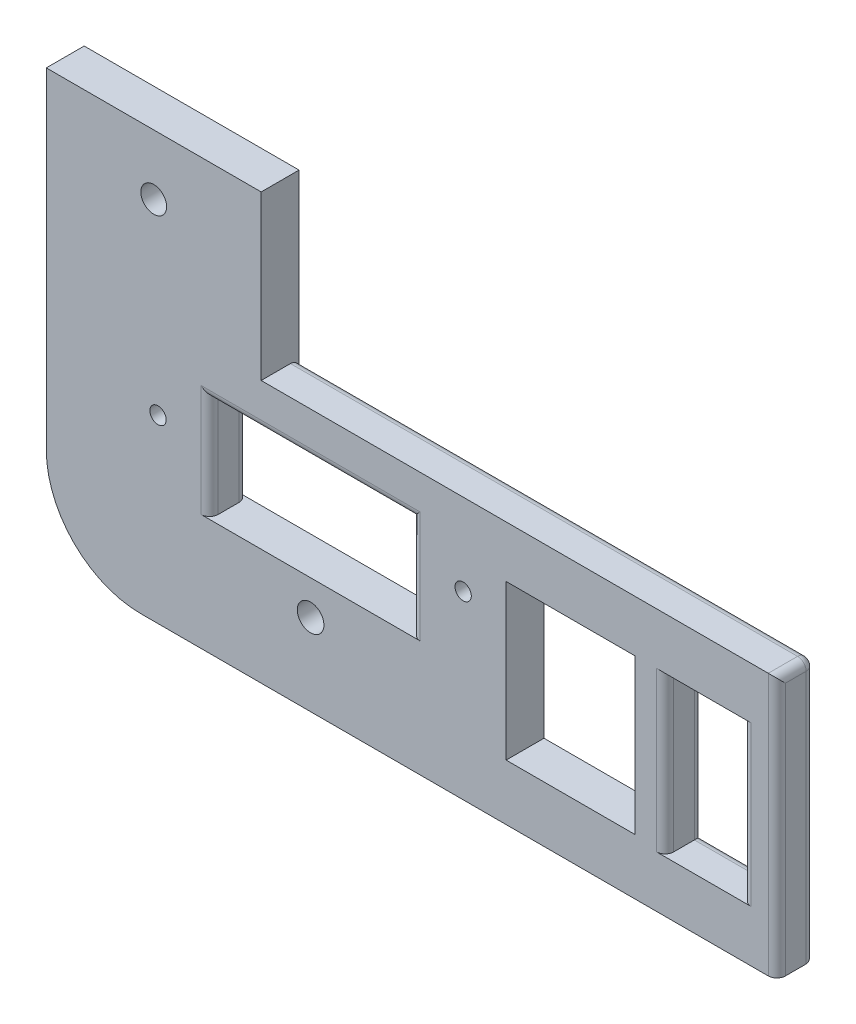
SolidWorks part; units mm, degrees
ref_plane "前视基准面" through (0, 0, 0) normal (0, 0, 1) x (1, 0, 0)
ref_plane "上视基准面" through (0, 0, 0) normal (0, 1, 0) x (1, 0, 0)
ref_plane "右视基准面" through (0, 0, 0) normal (1, 0, 0) x (0, 0, -1)
sketch "草图1" plane through (0, 0, 0) normal (0, 1, 0) x (1, 0, 0)
  line L1 (-37.5, -2.5) -> (37.5, -2.5)
  line L2 (-37.5, -2.5) -> (-37.5, 2.5)
  line L3 (-37.5, 2.5) -> (37.5, 2.5)
  line L4 (37.5, -2.5) -> (37.5, 2.5)
  line L5 (-37.5, -2.5) -> (37.5, 2.5) construction
  line L6 (-37.5, 2.5) -> (37.5, -2.5) construction
  point P0 (0, 0)
  dimension "D1" = 75
  dimension "D2" = 5
extrude "凸台-拉伸1" add sketch "草图1" along normal blind 30.5
sketch "草图2" plane through (0, 0, 0) normal (0, -1, 0) x (1, 0, 0)
  line L0 (37.5, 2.5) -> (37.5, -2.5) construction
  line L1 (-37.5, 2.5) -> (37.5, 2.5)
  line L2 (-37.5, 2.5) -> (-37.5, 6.8803)
  line L3 (-37.5, 6.8803) -> (37.5, 6.8803)
  line L4 (37.5, 2.5) -> (37.5, 6.8803)
sketch "草图9" plane through (0, 0, -2.5) normal (0, 0, -1) x (-1, 0, 0)
  line L1 (-37.5, 30.5) -> (37.5, 30.5)
  line L2 (-37.5, 30.5) -> (-37.5, 0)
  line L3 (-37.5, 0) -> (37.5, 0)
  line L4 (37.5, 30.5) -> (37.5, 0)
extrude "凸台-拉伸2" add sketch "草图9" along normal blind 18
sketch "草图10" plane through (37.5, 0, 0) normal (1, 0, 0) x (0, 0, -1)
  line L0 (-2.5, 30.5) -> (20.5, 30.5) construction
  line L1 (19, 30.5) -> (2, 30.5)
  line L2 (19, 30.5) -> (19, 0)
  line L3 (19, 0) -> (2, 0)
  line L4 (2, 30.5) -> (2, 0)
  line L5 (-2.5, 0) -> (20.5, 0) construction
  line L6 (20.5, 30.5) -> (20.5, 0) construction
  dimension "D1" = 17
  dimension "D2" = 1.5
extrude "切除-拉伸6" cut sketch "草图10" against normal blind 50
sketch "草图12" plane through (0, 0, -20.5) normal (0, 0, -1) x (-1, 0, 0)
  line L1 (-37.5, 30.5) -> (-37.5, 0) construction
  line L4 (37.5, 0) -> (37.5, 30.5) construction
  line L6 (37.5, 0) -> (-37.5, 0)
  line L7 (-37.5, 0) -> (-37.5, 7.8755)
  line L17 (37.5, 7.8755) -> (37.5, 0)
  line L33 (6, 7.8755) -> (37.5, 7.8755)
  line L35 (-37.5, 7.8755) -> (-6, 7.8755)
  line L36 (-6, 7.8755) -> (-6, 17.1015)
  line L37 (6, 7.8755) -> (6, 17.1015)
  line L38 (6, 17.1015) -> (-6, 17.1015)
extrude "切除-拉伸7" cut sketch "草图12" against normal blind 3
fillet "圆角4" radius 1 15 edges at (-37.5, 30.5, -9) (37.5, 19.1878, -20.5) (0, 30.5, -20.5) (37.5, 15.25, -2) (-37.5, 19.1878, -20.5) (-37.5, 0, -7.5) (-37.5, 3.9378, -17.5) (-37.5, 7.8755, -19) (21.75, 7.8755, -20.5) (-21.75, 7.8755, -20.5) (-6, 12.4885, -20.5) (0, 17.1015, -20.5) (6, 12.4885, -20.5) (37.5, 0, 0.25) (-37.5, 15.25, 2.5)
sketch "草图13" plane through (0, 0, -2) normal (0, 0, -1) x (-1, 0, 0)
  line L0 (-37.5, 7.8755) -> (-37.5, 29.5) construction
  line L1 (-37.5, 27.5) -> (-23.0283, 27.5)
  line L2 (-37.5, 27.5) -> (-37.5, 7.8391)
  line L3 (-37.5, 7.8391) -> (-23.0283, 7.8391)
  line L4 (-23.0283, 27.5) -> (-23.0283, 7.8391)
  dimension "D1" = 0
extrude "凸台-拉伸3" add sketch "草图13" along normal blind 18
sketch "草图14" plane through (0, 0, 2.5) normal (0, 0, 1) x (1, 0, 0)
  line L0 (-37.5, 0) -> (37.5, 0) construction
  line L1 (-36.5, 30.5) -> (37.5, 30.5) construction
  line L3 (37.5, 30.5) -> (37.5, 1) construction
  circle A0 centre (-11, 21) radius 0.95
  circle A1 centre (24.5, 21) radius 0.95
  dimension "D1" = 9.5
  dimension "D5" = 1.9
  dimension "D6" = 1.9
  dimension "D2" = 9.5
  dimension "D3" = 35.5
  dimension "D4" = 13
  dimension "D7" = 21
extrude "切除-拉伸8" cut sketch "草图14" against normal blind 10
sketch "草图15" plane through (0, 0, 0) normal (0, -1, 0) x (1, 0, 0)
  line L1 (-49.3528, -27.582) -> (48.6246, -27.582)
  line L2 (-49.3528, -27.582) -> (-49.3528, -1.9067)
  line L3 (-49.3528, -1.9067) -> (48.6246, -1.9067)
  line L4 (48.6246, -27.582) -> (48.6246, -1.9067)
extrude "切除-拉伸9" cut sketch "草图15" against normal blind 50
sketch "草图17" plane through (0, 0, -1.9067) normal (0, 0, -1) x (-1, 0, 0)
  line L0 (-36.5, 0) -> (36.5, 0) construction
  line L1 (-23.3164, 23.05) -> (-25.6836, 23.05)
  line L2 (-25.6836, 23.05) -> (-26.8671, 21)
  line L3 (-26.8671, 21) -> (-25.6836, 18.95)
  line L4 (-25.6836, 18.95) -> (-23.3164, 18.95)
  line L5 (-23.3164, 18.95) -> (-22.1329, 21)
  line L6 (-22.1329, 21) -> (-23.3164, 23.05)
  line L7 (12.1836, 23.05) -> (9.8164, 23.05)
  line L8 (9.8164, 23.05) -> (8.6329, 21)
  line L9 (8.6329, 21) -> (9.8164, 18.95)
  line L10 (9.8164, 18.95) -> (12.1836, 18.95)
  line L11 (12.1836, 18.95) -> (13.3671, 21)
  line L12 (13.3671, 21) -> (12.1836, 23.05)
  circle A0 centre (-24.5, 21) radius 2.05 construction
  circle A1 centre (11, 21) radius 2.05 construction
  dimension "D1" = 4.1
  dimension "D2" = 4.1
extrude "切除-拉伸11" cut sketch "草图17" against normal blind 2
sketch "草图18" plane through (0, 0, -1.9067) normal (0, 0, -1) x (-1, 0, 0)
  line L0 (11, 21) -> (-24.5, 21)
  line L1 (-6.75, 21) -> (-6.75, 0)
  line L2 (-36.5, 0) -> (36.5, 0) construction
  line L3 (-6.75, 0) -> (-6.75, 9.5)
  line L4 (-6.75, 9.5) -> (-6.75, 2.75)
  circle A0 centre (-6.75, 9.5) radius 1.55
  point P13 (-6.75, 2.75)
  dimension "D2" = 3.1
  dimension "D1" = 9.5
extrude "切除-拉伸15" cut sketch "草图18" against normal through all and the other way through all contours L1 A0 | L1 A0
sketch "草图19" plane through (0, 30.5, 0) normal (0, 1, 0) x (1, 0, 0)
  line L1 (-37.5, 1.9067) -> (37.5, 1.9067)
  line L2 (-37.5, 1.9067) -> (-37.5, -2.5)
  line L3 (-37.5, -2.5) -> (37.5, -2.5)
  line L4 (37.5, 1.9067) -> (37.5, -2.5)
fillet "圆角12" radius 1 1 edges at (37.5, 30.5, 0.75)
sketch "草图21" plane through (0, 0, -1.9067) normal (0, 0, -1) x (-1, 0, 0)
  line L0 (11, 21) -> (-24.5, 21)
  line L1 (37.5, 30.5) -> (-37.5, 30.5) construction
  line L2 (-18.5, 25.5) -> (5, 25.5)
  line L3 (-18.5, 25.5) -> (-18.5, 16.5)
  line L4 (-18.5, 16.5) -> (5, 16.5)
  line L5 (5, 25.5) -> (5, 16.5)
  line L6 (-18.5, 25.5) -> (5, 16.5) construction
  line L7 (-18.5, 16.5) -> (5, 25.5) construction
  line L9 (-18.5, 16.5) -> (5, 16.5)
  line L10 (-18.5, 16.5) -> (-18.5, 13.5)
  line L11 (-18.5, 13.5) -> (5, 13.5)
  line L12 (5, 16.5) -> (5, 13.5)
  point P4 (-6.75, 21)
  dimension "D1" = 6
  dimension "D2" = 5
  dimension "D3" = 3
extrude "切除-拉伸19" cut sketch "草图21" against normal through all contours L5 L0 L3 L4 | L5 L2 L3 L0 | L12 L4 L10 L11
fillet "圆角13" radius 1 6 edges at (-5, 19.5, 2.5) (6.75, 25.5, 2.5) (18.5, 19.5, 2.5) (6.75, 25.5, -1.9067) (18.5, 19.5, -1.9067) (-5, 19.5, -1.9067)
sketch "草图22" plane through (0, 0, -1.9067) normal (0, 0, -1) x (-1, 0, 0)
  line L0 (-37.5, 28.7003) -> (-37.5, -2.6539)
  line L1 (-37.5, 1) -> (-37.5, 29.5) construction
  line L2 (37.5, 0) -> (-37.5, 0) construction
  line L3 (-10.665, 0) -> (-42.7082, 0)
  line L5 (-37.5, 0) -> (-26.5, 0)
  line L6 (-37.5, 0) -> (-37.5, 11)
  line L7 (-37.5, 11) -> (-26.5, 11)
  line L8 (-26.5, 0) -> (-26.5, 11)
  circle A0 centre (-26.5, 11) radius 11
  dimension "D1" = 11
  dimension "D2" = 11
extrude "切除-拉伸20" cut sketch "草图22" against normal blind 10 contours A0 M11 M12 M13 | A0 L0 L3 M12 M11
sketch "草图23" plane through (0, 0, -1.9067) normal (0, 0, -1) x (-1, 0, 0)
  line L1 (16, 24.5) -> (31, 24.5)
  line L2 (16, 24.5) -> (16, 6.5)
  line L3 (16, 6.5) -> (31, 6.5)
  line L4 (31, 24.5) -> (31, 6.5)
  line L5 (37.5, 30.5) -> (-37.5, 30.5) construction
  line L6 (37.5, 0) -> (-37.5, 0) construction
  line L7 (5, 13.5) -> (5, 25.5) construction
  dimension "D1" = 11
  dimension "D2" = 15
  dimension "D3" = 6
  dimension "D4" = 6.5
extrude "切除-拉伸21" cut sketch "草图23" against normal through all contours L2 L1 L4 L3
ref_plane "基准面2" through (-36.5, 0, 0) normal (-1, 0, 0) x (0, 0, 1)
sketch "草图24" plane through (-36.5, 0, 0) normal (-1, 0, 0) x (0, 0, 1)
  line L0 (2.5, 30.5) -> (2.5, 0) construction
  line L1 (-1.9067, 0) -> (2.5, 0)
  line L2 (-1.9067, 0) -> (-1.9067, 6)
  line L3 (-1.9067, 6) -> (2.5, 6)
  line L4 (2.5, 0) -> (2.5, 6)
  line L5 (-1.9067, 30.5) -> (2.5, 30.5)
  line L6 (-1.9067, 30.5) -> (-1.9067, 24.5)
  line L7 (-1.9067, 24.5) -> (2.5, 24.5)
  line L8 (2.5, 30.5) -> (2.5, 24.5)
  dimension "D1" = 6
extrude "凸台-拉伸4" add sketch "草图24" along normal blind 11
sketch "草图25" plane through (0, 6, 0) normal (0, 1, 0) x (1, 0, 0)
  line L0 (-47.5, 1.9067) -> (-37.5, 1.9067) construction
  line L1 (-47.5, -2.5) -> (-43.5, -2.5)
  line L2 (-47.5, -2.5) -> (-47.5, 1.9067)
  line L3 (-47.5, 1.9067) -> (-43.5, 1.9067)
  line L4 (-43.5, -2.5) -> (-43.5, 1.9067)
  dimension "D1" = 4
extrude "凸台-拉伸5" add sketch "草图25" along normal blind 20
sketch "草图26" plane through (-37.5, 0, 0) normal (-1, 0, 0) x (0, 0, 1)
  line L0 (-1.9067, 24.5) -> (1.5, 24.5) construction
  line L1 (-1.9067, 6) -> (4.9751, 6)
  line L2 (-1.9067, 6) -> (-1.9067, 24.5)
  line L3 (-1.9067, 24.5) -> (4.9751, 24.5)
  line L4 (4.9751, 6) -> (4.9751, 24.5)
extrude "切除-拉伸22" cut sketch "草图26" against normal blind 3
ref_plane "基准面1" through (-47.5, 0, 0) normal (-1, 0, 0) x (0, 0, 1)
mirror "镜向1" about plane through (-47.5, 0, 0) normal (-1, 0, 0)
delete or keep bodies "实体-删除/保留 2" type delete bodies bodies 135
fillet "圆角14" radius 1 9 edges at (-89.5, 30.5, -1.9067) (-131.9219, 18.9437, -1.9067) (-131.716, 30.4764, -1.9067) (-132.3432, 30.0376, -1.5376) (-132.5, 20.25, -1) (-132.3817, 9.3914, -1.4717) (-84.5, 0, -1.9067) (-127.9144, 2.0638, -1.9067) (-47.5, 15.25, -1.9067)
fillet "圆角15" radius 1 3 edges at (-47.5, 15.25, 2.5) (-47.5, 30.5, 0.7967) (-47.7929, 30.2071, -1.6138)
fillet "圆角16" radius 1 6 edges at (-56, 6, -1.9067) (-51.5, 15.25, -1.9067) (-51.5, 15.25, 2.5) (-60.5, 15.25, 2.5) (-60.5, 15.25, -1.9067) (-56, 24.5, -1.9067)
ref_plane "基准面3" through (0, 29.5, 0) normal (0, 1, 0) x (1, 0, 0)
sketch "草图27" plane through (0, 29.5, 0) normal (0, 1, 0) x (1, 0, 0)
  line L0 (-131.5, 1.9067) -> (-48.5, 1.9067) construction
  line L1 (-132.5, -2.5) -> (-107.5, -2.5)
  line L2 (-132.5, -2.5) -> (-132.5, 1.9067)
  line L3 (-132.5, 1.9067) -> (-107.5, 1.9067)
  line L4 (-107.5, -2.5) -> (-107.5, 1.9067)
  dimension "D1" = 25
extrude "凸台-拉伸6" add sketch "草图27" along normal blind 20
sketch "草图28" plane through (0, 0, -1.9067) normal (0, 0, -1) x (-1, 0, 0)
  line L0 (48.5, 30.5) -> (107.5, 30.5) construction
  line L1 (132.5, 29.5) -> (107.5, 29.5)
  line L2 (132.5, 29.5) -> (132.5, 49.5)
  line L3 (132.5, 49.5) -> (107.5, 49.5)
  line L4 (107.5, 29.5) -> (107.5, 49.5)
  line L5 (120, 49.5) -> (120, 29.5)
  circle A1 centre (120, 42.5) radius 1.5
  dimension "D1" = 12
  dimension "D2" = 3
extrude "切除-拉伸24" cut sketch "草图28" against normal up to next contours L5 A1 | L5 A1
